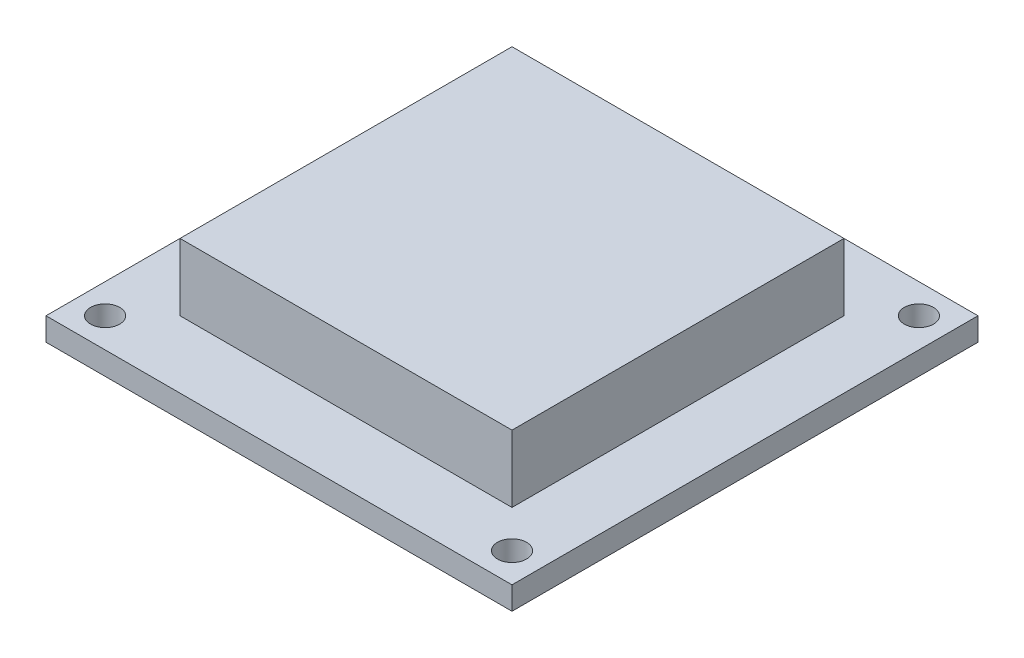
SolidWorks part; units mm, degrees
ref_plane "Front Plane" through (0, 0, 0) normal (0, 0, 1) x (1, 0, 0)
ref_plane "Top Plane" through (0, 0, 0) normal (0, 1, 0) x (1, 0, 0)
ref_plane "Right Plane" through (0, 0, 0) normal (1, 0, 0) x (0, 0, -1)
sketch "Sketch1" plane through (0, 0, 0) normal (0, 1, 0) x (1, 0, 0)
  line L1 (8, 8) -> (-8, 8)
  line L2 (8, 8) -> (8, -8)
  line L3 (8, -8) -> (-8, -8)
  line L4 (-8, 8) -> (-8, -8)
  line L5 (8, 8) -> (-8, -8) construction
  line L6 (8, -8) -> (-8, 8) construction
  point P0 (0, 0)
  dimension "D1" = 16
  dimension "D2" = 16
extrude "Boss-Extrude1" add sketch "Sketch1" along normal blind 0.7874
sketch "Sketch2" plane through (0, 0.7874, 0) normal (0, 1, 0) x (1, 0, 0)
  line L1 (5.7, 5.7) -> (-5.7, 5.7)
  line L2 (5.7, 5.7) -> (5.7, -5.7)
  line L3 (5.7, -5.7) -> (-5.7, -5.7)
  line L4 (-5.7, 5.7) -> (-5.7, -5.7)
  line L5 (5.7, 5.7) -> (-5.7, -5.7) construction
  line L6 (5.7, -5.7) -> (-5.7, 5.7) construction
  point P0 (0, 0)
  dimension "D1" = 11.4
  dimension "D2" = 11.4
extrude "Boss-Extrude2" add sketch "Sketch2" along normal blind 2.3
sketch "Sketch3" plane through (0, 0, 0) normal (0, -1, 0) x (1, 0, 0)
  line L1 (-6.985, 6.985) -> (6.985, 6.985) construction
  line L2 (-6.985, 6.985) -> (-6.985, -6.985) construction
  line L3 (-6.985, -6.985) -> (6.985, -6.985) construction
  line L4 (6.985, 6.985) -> (6.985, -6.985) construction
  line L5 (-6.985, 6.985) -> (6.985, -6.985) construction
  line L6 (-6.985, -6.985) -> (6.985, 6.985) construction
  circle A0 centre (-6.985, -6.985) radius 0.5
  circle A1 centre (6.985, -6.985) radius 0.5
  circle A2 centre (6.985, 6.985) radius 0.5
  circle A3 centre (-6.985, 6.985) radius 0.5
  point P0 (0, 0)
  dimension "D2" = 1
  dimension "D1" = 13.97
extrude "Cut-Extrude1" cut sketch "Sketch3" against normal through all
